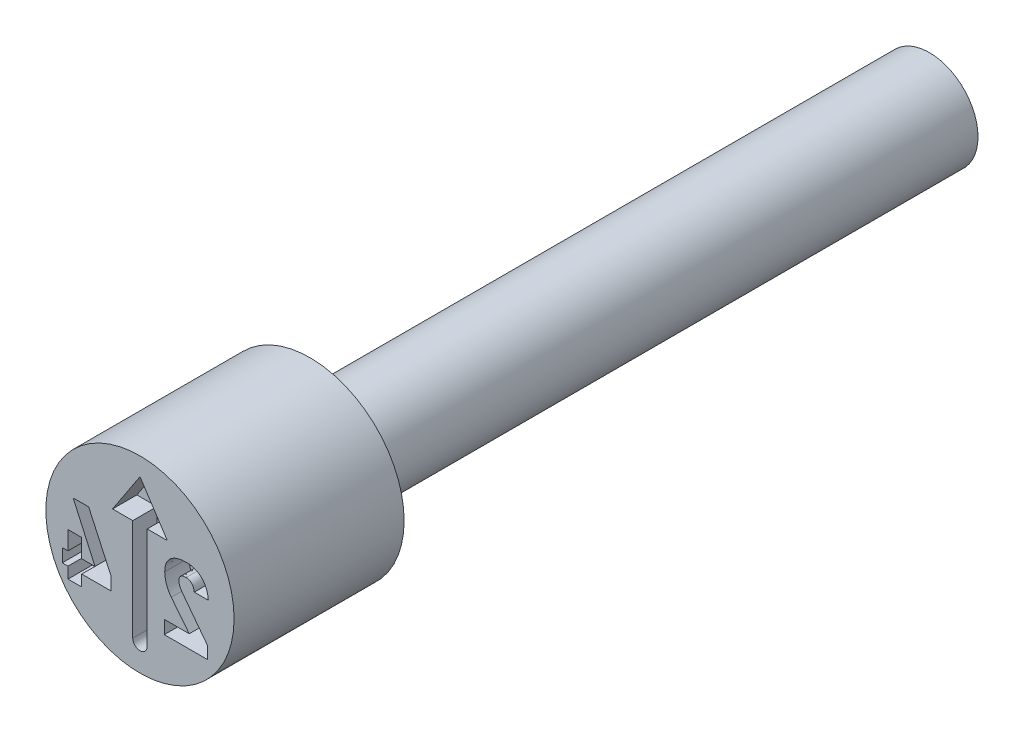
SolidWorks part; units mm, degrees
ref_plane "Front Plane" through (0, 0, 0) normal (0, 0, 1) x (1, 0, 0)
ref_plane "Top Plane" through (0, 0, 0) normal (0, 1, 0) x (1, 0, 0)
ref_plane "Right Plane" through (0, 0, 0) normal (1, 0, 0) x (0, 0, -1)
sketch "Sketch2" plane through (0, 0, 0) normal (1, 0, 0) x (0, 0, -1)
  line L0 (0.4039, 0) -> (50000.4039, 0) construction
  line L6 (0, 1.55) -> (0, 0)
  line L7 (2.8, 1.55) -> (0, 1.55)
  line L8 (2.8, 0.8) -> (2.8, 1.55)
  line L9 (13, 0.8) -> (2.8, 0.8)
  line L10 (13, 0) -> (13, 0.8)
  line L11 (0, 0) -> (13, 0)
  dimension "D1" = 3.1
  dimension "D2" = 1.6
  dimension "D3" = 13
  dimension "D4" = 2.8
revolve "Revolve1" add sketch "Sketch2" angle 360 about L0
sketch "Sketch3" plane through (0, 0, 0) normal (0, 0, 1) x (1, 0, 0)
  line L0 (0, 0) -> (0, 62500) construction
  line L1 (0.119, 0.5665) -> (0.119, -1.1101)
  line L2 (0.4512, 0.5665) -> (0.119, 0.5665)
  line L3 (0, 1.2513) -> (0.4512, 0.5665)
  line L15 (0, 1.2513) -> (-0.4512, 0.5665)
  line L16 (-0.4512, 0.5665) -> (-0.119, 0.5665)
  line L17 (-0.119, 0.5665) -> (-0.119, -1.1101)
  arc A2 (-0.119, -1.1101) -> (0.119, -1.1101) centre (0, -1.1101) ccw
extrude "Cut-Extrude4" cut sketch "Sketch3" against normal blind 0.4
sketch "Sketch4" plane through (0, 0, 0) normal (0, 0, 1) x (1, 0, 0)
  text T0 "2  4" font "Bahnschrift" height 1.2
  dimension "D1" = 0.8
  dimension "D2" = 1.2
extrude "Cut-Extrude5" cut sketch "Sketch4" against normal blind 0.4
